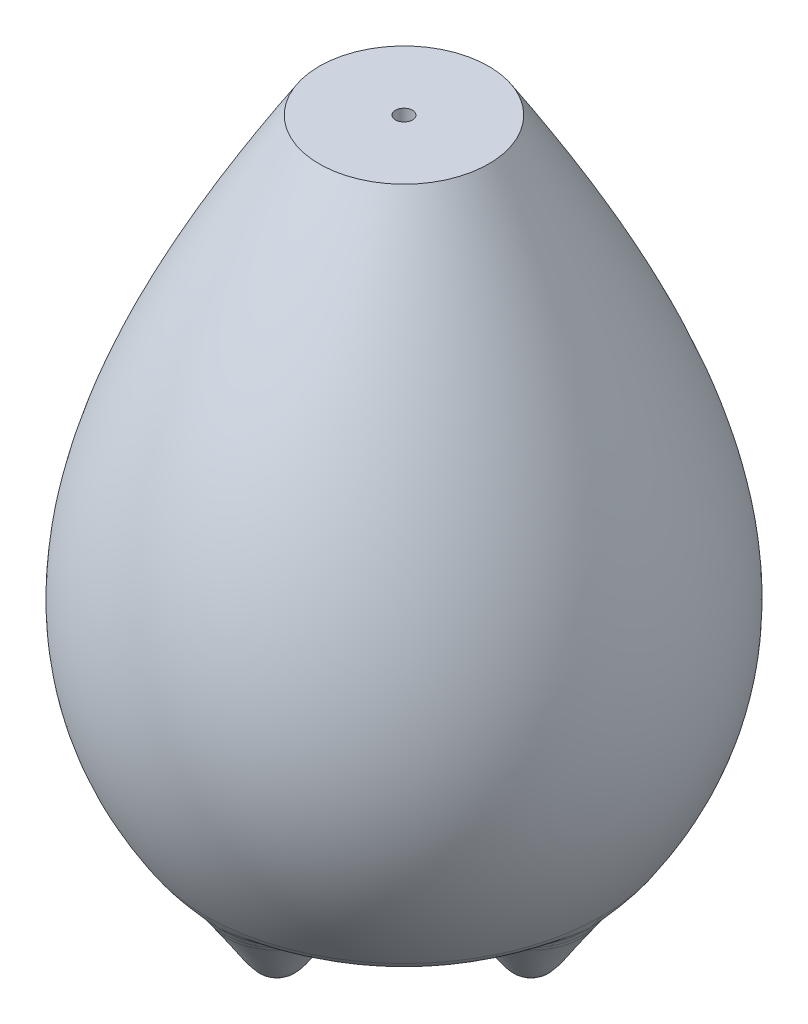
SolidWorks part; units mm, degrees
ref_plane "Alzado" through (0, 0, 0) normal (0, 0, 1) x (1, 0, 0)
ref_plane "Planta" through (0, 0, 0) normal (0, 1, 0) x (1, 0, 0)
ref_plane "Vista lateral" through (0, 0, 0) normal (1, 0, 0) x (0, 0, -1)
sketch "Croquis1" plane through (0, 0, 0) normal (0, 0, 1) x (1, 0, 0)
  line L0 (0, 106.4603) -> (0, -106.4603) construction
  line L1 (-50, 225) -> (50, 225) construction
  line L2 (-75, -175) -> (75, -175) construction
  line L3 (-140, -80) -> (140, -80) construction
  line L4 (-142.7957, -135) -> (142.7957, -135) construction
  line L5 (-50, 225) -> (0, 225)
  line L6 (0, 225) -> (0, -135)
  line L7 (0, -175) -> (-75, -175) construction
  line L8 (-140, -211.4552) -> (-140, 151.657) construction
  line L9 (-142.7957, -135) -> (142.7957, -135) construction
  line L10 (-110.614, -135) -> (0, -135)
  spline S0 degree 3 poles (-110.614, -135) (-177.9418, -43.1441) (-157.7371, 56.1559) (-50, 225) knots 0.128835 0.128835 0.128835 0.128835 1 1 1 1
  point P4 (0, 0)
  point P8 (0, 225)
  point P11 (0, -175)
  point P14 (0, -80)
  point P17 (0, -135)
  dimension "D1" = 280
  dimension "D2" = 225
  dimension "D3" = 135
  dimension "D4" = 100
  dimension "D5" = 150
  dimension "D6" = 80
revolve "Revolución1" add sketch "Croquis1" angle 360 about L6
sketch "Croquis3" plane through (0, 0, 0) normal (0, 0, 1) x (1, 0, 0)
  line L0 (0, -175) -> (-75, -175) construction
  line L1 (-74.9999, -175) -> (-74.9999, -126.555)
  line L2 (-74.9999, -126.555) -> (-106.6794, -130.5536)
  line L3 (-106.6794, -130.5536) -> (-110.614, -135)
  spline S0 degree 3 poles (-110.614, -135) (-86.5178, -167.9065) (-87.4494, -175) (-74.9999, -175) (-74.9999, -175) knots 0 0 0 0 0.276924 0.276925 0.276925 0.276925 0.276925
  spline S2 degree 3 number of poles 942 (-50, 225) -> (-110.614, -135) construction
  dimension "D1" = 175
  dimension "D2" = 75
revolve "Revolución2" add sketch "Croquis3" angle 360 about L1
pattern_circular "MatrizC2" count 4 over 360 about axis through (0, -135, 0) along (0, 1, 0) of "Revolución2"
fillet "Redondeo2" radius 20 8 edges at (78.2159, -135, 78.2159) (-35.6142, -135, 74.9999) (78.2159, -135, -78.2159) (74.9999, -135, 35.6142) (-78.2159, -135, -78.2159) (35.6142, -135, -74.9999) (-78.2159, -135, 78.2159) (-74.9999, -135, -35.6142)
sketch "Croquis4" plane through (0, -135, 0) normal (0, -1, 0) x (1, 0, 0)
  circle A0 centre (0, 0) radius 30
  dimension "D1" = 60
extrude "Cortar-Extruir1" cut sketch "Croquis4" against normal blind 20
fillet "Redondeo3" radius 20 16 edges at (21.2132, -135, -21.2132) (29.1086, -135, 0) (21.2132, -135, 21.2132) (0, -135, 29.1086) (-21.2132, -135, 21.2132) (-21.2132, -135, -21.2132) (0, -135, -29.1086) (30, -135, 0) (0, -135, 30) (0, -135, -30) (-30, -135, 0)
sketch "Croquis5" plane through (0, -115, 0) normal (0, -1, 0) x (1, 0, 0)
  circle A0 centre (0, 0) radius 5
  dimension "D1" = 10
extrude "Cortar-Extruir2" cut sketch "Croquis5" against normal through all
